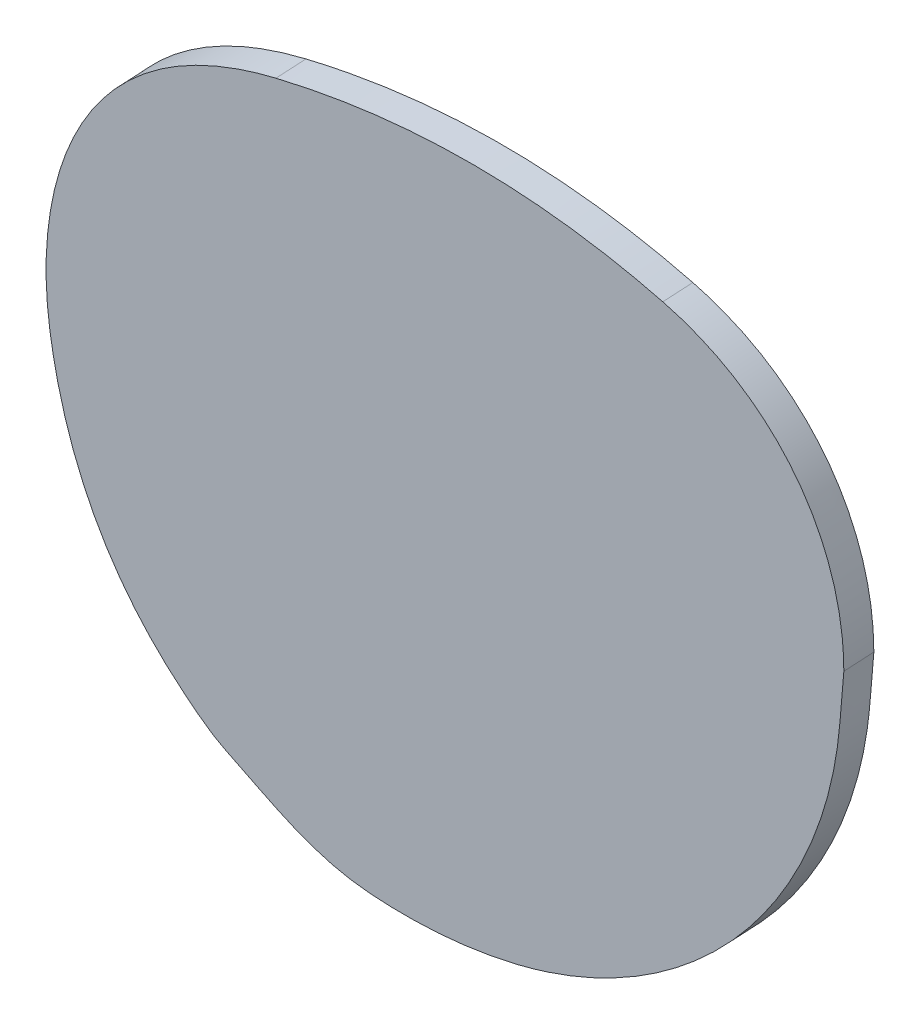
SolidWorks part; units mm, degrees
ref_plane "Front Plane" through (0, 0, 0) normal (0, 0, 1) x (1, 0, 0)
ref_plane "Top Plane" through (0, 0, 0) normal (0, 1, 0) x (1, 0, 0)
ref_plane "Right Plane" through (0, 0, 0) normal (1, 0, 0) x (0, 0, -1)
sketch "Sketch1" plane through (1.4941, 0, 28.5101) normal (-0.0523, 0, -0.9986) x (-0.9986, 0, 0.0523)
  spline S0 degree 3 poles (-2987.2167, 228.592) (875.381, -303.1614) (-34.6101, -52.8095) (-4.9301, 43.972) (-4.7914, 44.3678) (-4.4856, 45.1395) (-4.3181, 45.5172) (-3.772, 46.6259) (-3.35, 47.3325) (-2.6273, 48.3422) (-2.3705, 48.6714) (-1.8296, 49.3077) (-1.5477, 49.6124) (-0.6686, 50.4874) (-0.0382, 51.019) (1.3092, 51.9808) (2.031, 52.4124) (93.6485, 97.9196) (576.9638, -727.1864) (-941.3578, 2886.3527) knots -14.897129 -14.897129 -14.897129 -14.897129 0.25 0.25 0.3125 0.3125 0.375 0.375 0.5 0.5 0.5625 0.5625 0.625 0.625 0.75 0.75 0.875 0.875 16.133461 16.133461 16.133461 16.133461 only from (-5.7735, 38.6803) to (5.0865, 53.7192) construction
  spline S1 degree 3 poles (-1309.1947, 2665.9705) (-34.5338, -1573.7) (-203.8275, 15.6138) (12.7184, 55.5133) (14.6672, 55.7409) (17.6071, 55.8893) (18.5895, 55.9065) (20.5451, 55.878) (21.5202, 55.8324) (199.7806, 41.9309) (291.7397, -975.6988) (800.5279, 2910.2283) knots -27.536038 -27.536038 -27.536038 -27.536038 0.25 0.25 0.5 0.5 0.625 0.625 0.75 0.75 23.536774 23.536774 23.536774 23.536774 only from (5.0865, 53.7192) to (28.2978, 54.9468) construction
  spline S2 degree 3 poles (853.7096, 2934.1048) (-223.2474, -244.2727) (-33.1757, 78.022) (32.0907, 53.8363) (32.6107, 53.6173) (33.6318, 53.1272) (34.1358, 52.8543) (35.5914, 51.962) (36.4847, 51.2722) (37.6999, 50.0842) (38.0864, 49.6594) (38.8019, 48.7739) (39.4603, 47.8536) (40.011, 46.8675) (40.51, 45.8498) (40.7346, 45.3223) (41.3239, 43.7195) (41.6071, 42.6237) (41.8916, 40.9451) (41.9629, 40.3776) (42.0591, 39.2433) (42.0843, 38.6766) (43.0147, -107.2353) (-1359.345, -226.9159) (-2928.9695, -343.5375) knots -7.532409 -7.532409 -7.532409 -7.532409 0.125 0.125 0.1875 0.1875 0.25 0.25 0.375 0.375 0.4375 0.4375 0.5 0.5625 0.5625 0.625 0.625 0.75 0.75 0.8125 0.8125 0.875 0.875 16.915151 16.915151 16.915151 16.915151 only from (28.2978, 54.9468) to (41.8545, 34.7169) construction
  spline S3 degree 3 poles (3006.706, -368.3882) (-297.8095, 286.4319) (65.6788, 114.5914) (40.6795, 29.5251) (40.4354, 28.8018) (39.8912, 27.3898) (39.5903, 26.6985) (38.5974, 24.6715) (37.8152, 23.3822) (36.4435, 21.5505) (35.9559, 20.9612) (-56.5033, -80.584) (-1000.7326, 604.2596) (1923.3896, -2277.6114) knots -14.169191 -14.169191 -14.169191 -14.169191 0.25 0.25 0.375 0.375 0.5 0.5 0.75 0.75 0.875 0.875 23.289227 23.289227 23.289227 23.289227 only from (41.8545, 34.7169) to (33.8261, 18.7811) construction
  spline S4 degree 3 poles (1987.4653, -2257.0311) (29.6999, 101.747) (52.6598, 34.099) (15.5962, 3.8136) (-30.6191, 27.058) (-1552.7394, 2563.9347) knots -24.320522 -24.320522 -24.320522 -24.320522 0.5 0.5 21.660232 21.660232 21.660232 21.660232 only from (33.8261, 18.7811) to (31.3758, 16.8579) construction
  spline S5 degree 3 poles (1621.7741, -2525.2339) (86.0137, 74.1568) (63.266, 35.1303) (28.608, 15.2693) (27.911, 14.8812) (26.4786, 14.1809) (25.7409, 13.8696) (-30.5686, -4.2832) (-188.6167, 340.2594) (-957.7871, 2845.9583) knots -12.017143 -12.017143 -12.017143 -12.017143 0.25 0.25 0.5 0.5 0.75 0.75 19.170773 19.170773 19.170773 19.170773 only from (31.3758, 16.8579) to (22.6671, 13.1021) construction
  spline S6 degree 3 poles (-2682.6951, 1242.129) (194.5266, 396.4168) (101.9135, 10.0254) (-73.6758, 16.0242) (-127.7233, 484.7567) (1872.147, 2330.1907) knots -27.619374 -27.619374 -27.619374 -27.619374 0.5 0.5 31.368333 31.368333 31.368333 31.368333 only from (22.6671, 13.1021) to (13.7836, 13.4079) construction
  spline S7 degree 3 poles (1341.0437, 2698.7374) (341.1589, 388.3261) (89.2499, -17.8595) (9.0011, 14.9311) (8.3508, 15.2323) (7.3933, 15.7301) (7.0771, 15.9037) (6.4509, 16.2664) (6.1405, 16.4558) (4.6189, 17.432) (3.4868, 18.3122) (1.9094, 19.7734) (1.4039, 20.2841) (0.4338, 21.3532) (-0.0315, 21.9131) (-1.3405, 23.6335) (-2.107, 24.8436) (-3.1006, 26.7515) (-3.4055, 27.4031) (-3.9616, 28.7383) (-4.2119, 29.4208) (-4.8703, 31.4881) (-5.1906, 32.9069) (-5.4826, 35.0632) (-5.5422, 35.787) (-9.6875, 86.4306) (9.7325, 138.2306) (-3002.1684, -52.2904) knots -7.384628 -7.384628 -7.384628 -7.384628 0.125 0.125 0.1875 0.1875 0.21875 0.21875 0.25 0.25 0.375 0.375 0.4375 0.4375 0.5 0.5 0.625 0.625 0.6875 0.6875 0.75 0.75 0.875 0.875 0.9375 0.9375 5.251641 5.251641 5.251641 5.251641 only from (13.7836, 13.4079) to (-5.7735, 38.6803) construction
  spline S8 degree 3 poles (-5.7735, 38.6803) (-5.7719, 40.3507) (-5.5399, 41.9835) (-4.9301, 43.972) (-4.7914, 44.3678) (-4.4856, 45.1395) (-4.3181, 45.5172) (-3.772, 46.6259) (-3.35, 47.3325) (-2.6273, 48.3422) (-2.3705, 48.6714) (-1.8296, 49.3077) (-1.5477, 49.6124) (-0.6686, 50.4874) (-0.0382, 51.019) (1.3092, 51.9808) (2.031, 52.4124) (3.5199, 53.1519) (4.2906, 53.4633) (5.0865, 53.7192) knots 0 0 0 0 0.25 0.25 0.3125 0.3125 0.375 0.375 0.5 0.5 0.5625 0.5625 0.625 0.625 0.75 0.75 0.875 0.875 1 1 1 1
  spline S9 degree 3 poles (5.0865, 53.7192) (6.9566, 54.3205) (8.8565, 54.8018) (12.7184, 55.5133) (14.6672, 55.7409) (17.6071, 55.8893) (18.5895, 55.9065) (20.5451, 55.878) (21.5202, 55.8324) (24.4378, 55.6049) (26.3726, 55.3323) (28.2978, 54.9468) knots 0 0 0 0 0.25 0.25 0.5 0.5 0.625 0.625 0.75 0.75 1 1 1 1
  spline S10 degree 3 poles (28.2978, 54.9468) (29.4153, 54.723) (30.5055, 54.4237) (32.0907, 53.8363) (32.6107, 53.6173) (33.6318, 53.1272) (34.1358, 52.8543) (35.5914, 51.962) (36.4847, 51.2722) (37.6999, 50.0842) (38.0864, 49.6594) (38.8019, 48.7739) (39.4603, 47.8536) (40.011, 46.8675) (40.51, 45.8498) (40.7346, 45.3223) (41.3239, 43.7195) (41.6071, 42.6237) (41.8916, 40.9451) (41.9629, 40.3776) (42.0591, 39.2433) (42.0843, 38.6766) (42.0951, 36.9776) (42.0171, 35.8465) (41.8545, 34.7169) knots 0 0 0 0 0.125 0.125 0.1875 0.1875 0.25 0.25 0.375 0.375 0.4375 0.4375 0.5 0.5625 0.5625 0.625 0.625 0.75 0.75 0.8125 0.8125 0.875 0.875 1 1 1 1
  spline S11 degree 3 poles (41.8545, 34.7169) (41.637, 33.2069) (41.324, 31.7184) (40.6795, 29.5251) (40.4354, 28.8018) (39.8912, 27.3898) (39.5903, 26.6985) (38.5974, 24.6715) (37.8152, 23.3822) (36.4435, 21.5505) (35.9559, 20.9612) (34.9304, 19.8348) (34.3911, 19.2961) (33.8261, 18.7811) knots 0 0 0 0 0.25 0.25 0.375 0.375 0.5 0.5 0.75 0.75 0.875 0.875 1 1 1 1
  spline S12 degree 3 poles (33.8261, 18.7811) (33.4414, 18.4304) (33.0558, 18.0802) (32.2497, 17.4216) (31.8304, 17.113) (31.3758, 16.8579) knots 0 0 0 0 0.5 0.5 1 1 1 1
  spline S13 degree 3 poles (31.3758, 16.8579) (30.68, 16.4674) (29.9924, 16.0626) (28.608, 15.2693) (27.911, 14.8812) (26.4786, 14.1809) (25.7409, 13.8696) (24.2329, 13.3835) (23.4601, 13.2072) (22.6671, 13.1021) knots 0 0 0 0 0.25 0.25 0.5 0.5 0.75 0.75 1 1 1 1
  spline S14 degree 3 poles (22.6671, 13.1021) (21.1898, 12.9064) (19.6987, 12.8342) (16.722, 12.9359) (15.2435, 13.1089) (13.7836, 13.4079) knots 0 0 0 0 0.5 0.5 1 1 1 1
  spline S15 degree 3 poles (13.7836, 13.4079) (12.3607, 13.6994) (10.9882, 14.1191) (9.0011, 14.9311) (8.3508, 15.2323) (7.3933, 15.7301) (7.0771, 15.9037) (6.4509, 16.2664) (6.1405, 16.4558) (4.6189, 17.432) (3.4868, 18.3122) (1.9094, 19.7734) (1.4039, 20.2841) (0.4338, 21.3532) (-0.0315, 21.9131) (-1.3405, 23.6335) (-2.107, 24.8436) (-3.1006, 26.7515) (-3.4055, 27.4031) (-3.9616, 28.7383) (-4.2119, 29.4208) (-4.8703, 31.4881) (-5.1906, 32.9069) (-5.4826, 35.0632) (-5.5422, 35.787) (-5.6606, 37.2334) (-5.7149, 37.957) (-5.7735, 38.6803) knots 0 0 0 0 0.125 0.125 0.1875 0.1875 0.21875 0.21875 0.25 0.25 0.375 0.375 0.4375 0.4375 0.5 0.5 0.625 0.625 0.6875 0.6875 0.75 0.75 0.875 0.875 0.9375 0.9375 1 1 1 1
extrude "Boss-Extrude1" add sketch "Sketch1" along normal blind 2
